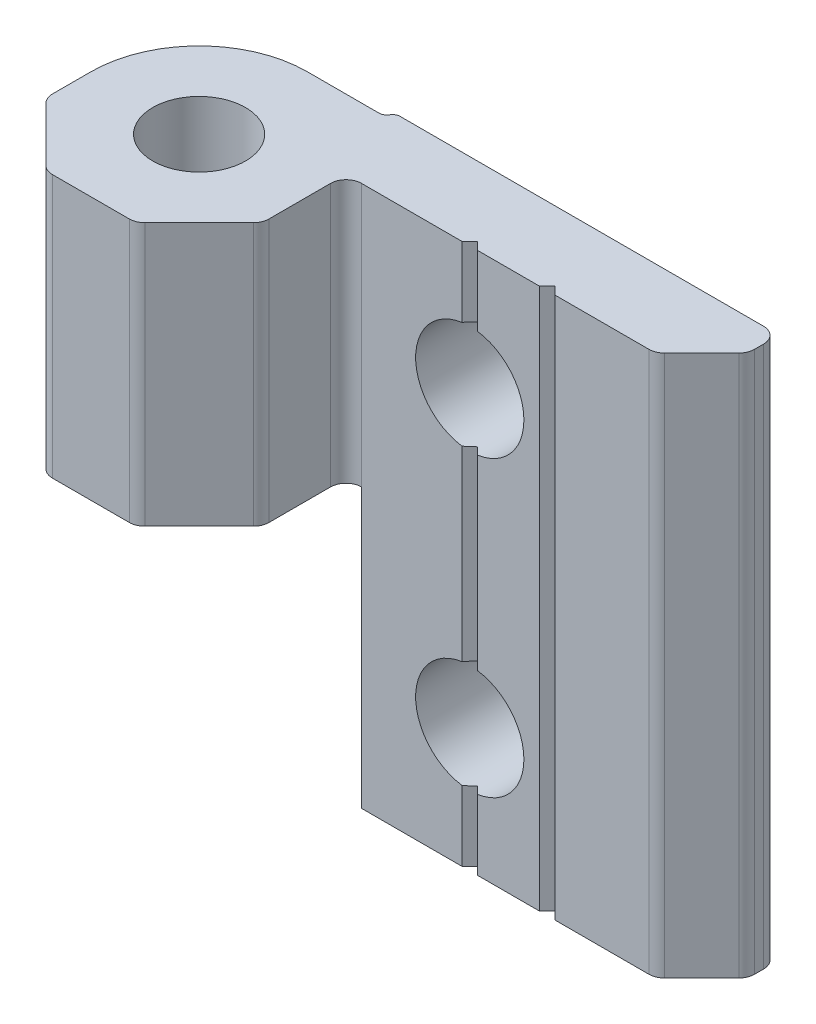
SolidWorks part; units mm, degrees
ref_plane "正面" through (0, 0, 0) normal (0, 0, 1) x (1, 0, 0)
ref_plane "平面" through (0, 0, 0) normal (0, 1, 0) x (1, 0, 0)
ref_plane "右側面" through (0, 0, 0) normal (1, 0, 0) x (0, 0, -1)
sketch "ｽｹｯﾁ1" plane through (0, 0, 0) normal (0, 1, 0) x (1, 0, 0)
  line L16 (30, 5.9142) -> (30, 6.5)
  line L17 (29.7071, 5.2071) -> (27.2929, 2.7929)
  line L18 (19.5, 2.5) -> (15.5, 2.5)
  line L19 (15, 3) -> (15.5, 2.5)
  line L20 (15, 3) -> (14.5, 2.5)
  line L21 (20, 3) -> (19.5, 2.5)
  line L22 (20, 3) -> (20.5, 2.5)
  line L23 (7, -2.4853) -> (7, 1.5)
  line L24 (14.5, 2.5) -> (8, 2.5)
  line L25 (0, 7) -> (4.634, 7)
  line L26 (-7, 0) -> (-7, -2.4853)
  line L27 (-2.4853, -7) -> (2.4853, -7)
  line L28 (-6.7071, -3.1924) -> (-3.1924, -6.7071)
  line L29 (3.1924, -6.7071) -> (6.7071, -3.1924)
  line L30 (29, 7.5) -> (5.5, 7.5)
  line L31 (26.5858, 2.5) -> (20.5, 2.5)
  arc A12 (26.5858, 2.5) -> (27.2929, 2.7929) centre (26.5858, 3.5) ccw
  arc A13 (30, 6.5) -> (29, 7.5) centre (29, 6.5) ccw
  arc A14 (29.7071, 5.2071) -> (30, 5.9142) centre (29, 5.9142) ccw
  arc A15 (8, 2.5) -> (7, 1.5) centre (8, 1.5) ccw
  arc A16 (6.7071, -3.1924) -> (7, -2.4853) centre (6, -2.4853) ccw
  arc A17 (4.634, 7) -> (5.067, 7.25) centre (4.634, 7.5) ccw
  arc A18 (0, 7) -> (-7, 0) centre (0, 0) ccw
  arc A19 (2.4853, -7) -> (3.1924, -6.7071) centre (2.4853, -6) ccw
  arc A20 (-3.1924, -6.7071) -> (-2.4853, -7) centre (-2.4853, -6) ccw
  circle A21 centre (0, 0) radius 3
  arc A22 (-7, -2.4853) -> (-6.7071, -3.1924) centre (-6, -2.4853) ccw
  arc A23 (5.5, 7.5) -> (5.067, 7.25) centre (5.5, 7) ccw
  point P42 (0, 0.001)
  point P43 (0.001, 0.001)
  point P44 (0.001, 0)
extrude "ﾎﾞｽ - 押し出し1" add sketch "ｽｹｯﾁ1" along normal blind 35
sketch "ｽｹｯﾁ2" plane through (0, 0, -7.5) normal (0, 0, -1) x (-1, 0, 0)
  line L1 (-8, 0) -> (-14.5, 0) construction
  line L2 (7, 35) -> (7, 0) construction
  line L3 (-8, 18) -> (24.7564, 18)
  line L4 (-8, 18) -> (-8, -13.9233)
  line L6 (-8, -13.9233) -> (24.7564, -13.9233)
  line L9 (24.7564, 18) -> (24.7564, -13.9233)
  dimension "D1" = 15
  dimension "D2" = 18
extrude "ｶｯﾄ - 押し出し1" cut sketch "ｽｹｯﾁ2" against normal blind 35
hole_wizard "Ø7.0 (7) 直径の穴1" positions "3Dｽｹｯﾁ1" profile "ｽｹｯﾁ3" hole size "Ø7.0" standard "Jis"
sketch3d "3Dｽｹｯﾁ1"
  line L0 (20.5, 35, -2.5) -> (26.5858, 35, -2.5) construction
  line L1 (8, 0, -2.5) -> (8, 18, -2.5) construction
  point P14 (15, 27, -2.5)
  point P16 (15, 8, -2.5)
  dimension "D1" = 8
  dimension "D2" = 19
  dimension "D3" = 7
sketch "ｽｹｯﾁ3" plane through (15, 27, -2.5) normal (1, 0, 0) x (0, -1, 0)
  line L0 (0, 0) -> (0, 32.103)
  line L1 (0, 32.103) -> (3.5, 30)
  line L2 (3.5, 30) -> (3.5, 0)
  line L5 (3.5, 0) -> (0, 0)
  line L10 (0, 32.103) -> (-3.5, 30) construction
  line L11 (0, -6.35) -> (0, 107.95) construction
  dimension "穴の直径" = 7
  dimension "穴の深さ" = 30
  dimension "ﾄﾞﾘﾙ角度" = 118
